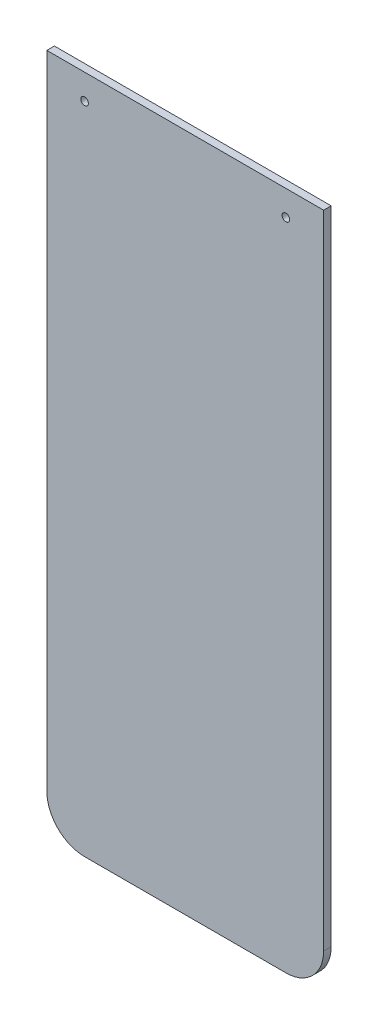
SolidWorks part; units mm, degrees
ref_plane "Front Plane" through (0, 0, 0) normal (0, 0, 1) x (1, 0, 0)
ref_plane "Top Plane" through (0, 0, 0) normal (0, 1, 0) x (1, 0, 0)
ref_plane "Right Plane" through (0, 0, 0) normal (1, 0, 0) x (0, 0, -1)
sketch "Sketch1" plane through (0, 0, 0) normal (0, 0, 1) x (1, 0, 0)
  line L1 (-55, -224) -> (55, -224)
  line L2 (-55, -224) -> (-55, -494)
  line L3 (-55, -494) -> (55, -494)
  line L4 (55, -224) -> (55, -494)
  circle A2 centre (40, -234) radius 1.5
  circle A3 centre (-40, -234) radius 1.5
  point P6 (0, 0)
  dimension "D2" = 270
extrude "Boss-Extrude1" add sketch "Sketch1" along normal blind 3
fillet "Fillet1" radius 15 2 edges at (-55, -494, 1.5) (55, -494, 1.5)
